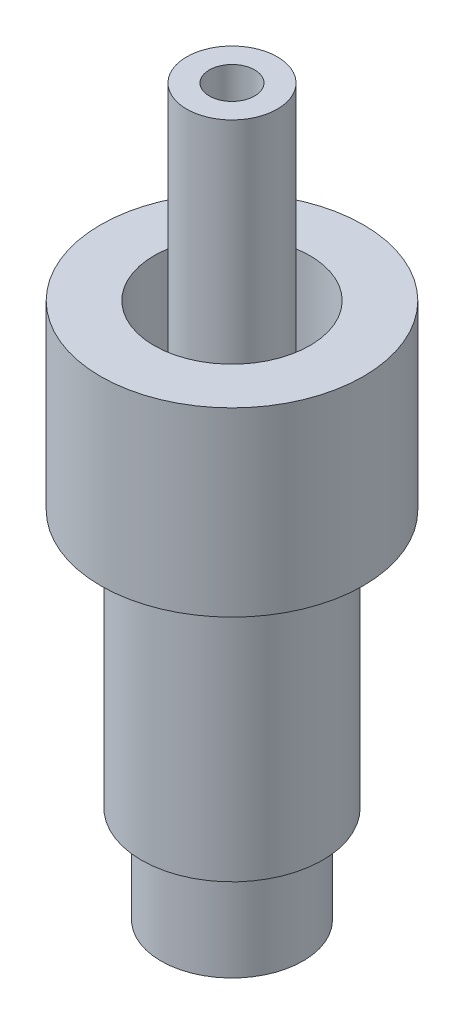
SolidWorks part; units mm, degrees
ref_plane "Front" through (0, 0, 0) normal (0, 0, 1) x (1, 0, 0)
ref_plane "Top" through (0, 0, 0) normal (0, 1, 0) x (1, 0, 0)
ref_plane "Right" through (0, 0, 0) normal (1, 0, 0) x (0, 0, -1)
sketch "Sketch1" plane through (0, 0, 0) normal (0, 0, 1) x (1, 0, 0)
  line L0 (-1.5875, 0) -> (-4.6037, 0)
  line L1 (-4.6037, 0) -> (-4.6037, -6.35)
  line L2 (-4.6037, -6.35) -> (-3.175, -6.35)
  line L3 (-3.175, -6.35) -> (-3.175, -15.3924)
  line L4 (-3.175, -15.3924) -> (-1.5875, -15.3924)
  line L5 (-1.5875, -15.3924) -> (-1.5875, 0)
  line L6 (0, 0) -> (0, -17.0013) construction
  dimension "D1" = 6.35
  dimension "D2" = 6.35
  dimension "D3" = 3.175
  dimension "D4" = 9.2075
  dimension "D5" = 15.3924
revolve "Revolve1" add sketch "Sketch1" angle 360 about L6
sketch "Sketch2" plane through (0, -15.3924, 0) normal (0, -1, 0) x (1, 0, 0)
  circle A0 centre (0, 0) radius 2.4892
  circle A1 centre (0, 0) radius 1.5875
  dimension "D1" = 3.175
  dimension "D2" = 4.9784
extrude "Boss-Extrude1" add sketch "Sketch2" along normal offset from surface (3.4036 mm away) 18.796 separate body
sketch "Sketch3" plane through (0, 0, 0) normal (0, 1, 0) x (1, 0, 0)
  circle A0 centre (0, 0) radius 2.7305
  dimension "D1" = 5.461
extrude "Cut-Extrude1" cut sketch "Sketch3" against normal blind 5.461
sketch "Sketch4" plane through (0, -18.796, 0) normal (0, -1, 0) x (1, 0, 0)
  circle A1 centre (0, 0) radius 0.7937
  circle A2 centre (0, 0) radius 1.5875 construction
  circle A3 centre (0, 0) radius 1.5875
  dimension "D1" = 1.5875
extrude "Boss-Extrude2" add sketch "Sketch4" against normal blind 25.4 separate body
